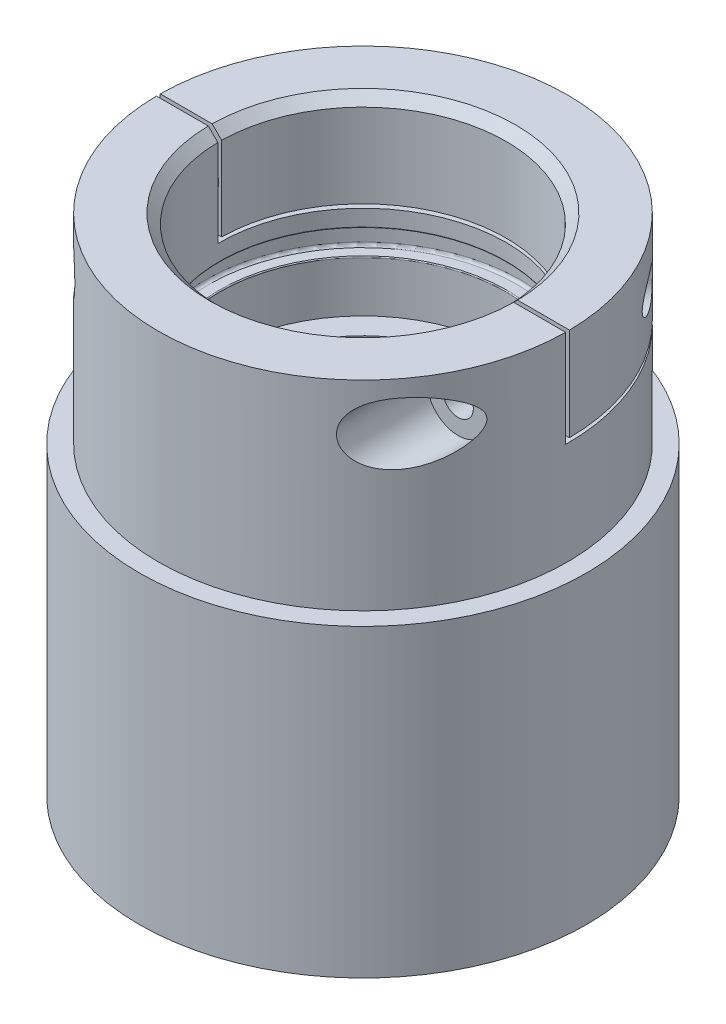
SolidWorks part; units mm, degrees
other "Vue éclatée1" [suppressed]
other "Etape d'éclatement1" [suppressed]
other "Ligne d'éclatement1"
ref_plane "Plan1" through (0, 0, 0) normal (0, 0, 1) x (1, 0, 0)
ref_plane "Plan2" through (0, 0, 0) normal (0, 1, 0) x (1, 0, 0)
ref_plane "Plan3" through (0, 0, 0) normal (1, 0, 0) x (0, 0, -1)
sketch "Esquisse1" plane through (0, 0, 0) normal (0, 0, 1) x (1, 0, 0)
  line L0 (0, 48.8191) -> (0, -8.4315) construction
  line L1 (0, -50) -> (0, 50) construction
  line L2 (15.05, 53) -> (15.05, 41)
  line L3 (12.5, 30) -> (19.3, 30)
  line L4 (19.3, 30) -> (19.3, 2.7475)
  line L5 (20.3, 0) -> (23.5, 0)
  line L6 (23.5, 0) -> (23.5, 32)
  line L7 (21.5, 53) -> (15.05, 53)
  line L8 (50, 0) -> (-50, 0) construction
  line L9 (19.3, 2.7475) -> (20.3, 0)
  line L10 (15.05, 41) -> (16.5, 41)
  line L11 (16.5, 41) -> (16.5, 38.4)
  line L12 (16.5, 38.4) -> (15.05, 38.4)
  line L13 (15.05, 38.4) -> (15.05, 33)
  line L14 (15.05, 33) -> (12.5, 33)
  line L15 (12.5, 33) -> (12.5, 30)
  line L16 (21.5, 32) -> (21.5, 53)
  line L17 (23.5, 32) -> (21.5, 32)
  circle A0 centre (15.825, 39.29) radius 0.89 construction
  dimension "D11" = 1.78
  dimension "D12" = 29.87
  dimension "D1" = 38.6
  dimension "D2" = 30.1
  dimension "D3" = 47
  dimension "D4" = 30
  dimension "D5" = 23
  dimension "D6" = 20
  dimension "D7" = 1
  dimension "D8" = 8
  dimension "D9" = 2.6
  dimension "D10" = 1.45
  dimension "D13" = 25
  dimension "D14" = 3
  dimension "D15" = 43
  dimension "D16" = 2
revolve "Révolution1" add sketch "Esquisse1" angle 360 about L0
hole_wizard "Trou taraudé M21" positions "Esquisse3" profile "Esquisse2" tap size "M2" standard "ISO"
sketch "Esquisse3" plane through (0, 0, 0) normal (0, -1, 0) x (-1, 0, 0)
  circle A0 centre (0, 0) radius 21.5
  point P5 (0, 21.5)
  dimension "D1" = 43
sketch "Esquisse2" plane through (0, 0, -21.5) normal (1, 0, 0) x (0, 0, -1)
  line L0 (0, 0) -> (0, 7.9807)
  line L1 (0, 7.9807) -> (0.8, 7.5)
  line L2 (0.8, 7.5) -> (0.8, 0)
  line L5 (0.8, 0) -> (0, 0)
  line L10 (0, 7.9807) -> (-0.8, 7.5) construction
  line L11 (0, -6.35) -> (0, 107.95) construction
  dimension "Diamètre du trou pour taraudage" = 1.6
  dimension "Profondeur du trou pour taraudage" = 7.5
  dimension "Angle de pointe" = 118
pattern_circular "Répétition circulaire1" count 3 over 360 about axis through (0, 0, 0) along (0, 1, 0) of "Trou taraudé M21"
sketch "Esquisse4" plane through (0, 0, 0) normal (0, 0, 1) x (1, 0, 0)
  line L0 (0, 48.8191) -> (0, -8.4315) construction
  line L1 (0, 48.8191) -> (0, -8.4315) construction
  circle A0 centre (15.825, 39.29) radius 0.89 construction
  circle A1 centre (15.825, 39.29) radius 0.89
revolve "Révolution2" add sketch "Esquisse4" angle 360 about L1
ref_plane "Plan4" through (0, 48, 0) normal (0, 1, 0) x (1, 0, 0)
sketch "Esquisse5" plane through (0, 48, 0) normal (0, 1, 0) x (1, 0, 0)
  line L0 (-17, 22.4362) -> (-17, -38.912) construction
  line L1 (0, -50) -> (0, 50) construction
  line L2 (-17, -27) -> (-17, 0)
  line L3 (-17, 0) -> (-15.4, 0)
  line L4 (-15.4, 0) -> (-15.4, -7)
  line L5 (-15.4, -7) -> (-13.75, -7)
  line L6 (-13.75, -7) -> (-13.75, -27)
  line L7 (-13.75, -27) -> (-17, -27)
  line L8 (-50, 0) -> (50, 0) construction
  dimension "D1" = 17
  dimension "D2" = 3.2
  dimension "D3" = 6.5
  dimension "D4" = 7
  dimension "D5" = 20
revolve "Enlèvement de matière-Révolution1" cut sketch "Esquisse5" angle 360 about L0
hole_wizard "Trou taraudé M41" positions "Esquisse7" profile "Esquisse6" tap size "M4" standard "ISO"
sketch "Esquisse7" plane through (0, 0, 0) normal (0, 0, 1) x (1, 0, 0)
  point P0 (-17, 48)
sketch "Esquisse6" plane through (-17, 48, 0) normal (1, 0, 0) x (0, -1, 0)
  line L0 (0, 0) -> (0, 23.5)
  line L1 (0, 23.5) -> (1.65, 23.5)
  line L2 (1.65, 23.5) -> (1.65, 0)
  line L5 (1.65, 0) -> (0, 0)
  line L11 (0, -6.35) -> (0, 107.95) construction
  dimension "Diamètre du trou pour taraudage jusqu'au prochain" = 3.3
  dimension "Profondeur du trou pour taraudage jusqu'au prochain" = 23.5
mirror "Symétrie1" about plane through (0, 0, 0) normal (1, 0, 0) of "Trou taraudé M41", "Enlèvement de matière-Révolution1"
sketch "Esquisse8" plane through (0, 0, 0) normal (1, 0, 0) x (0, 0, -1)
  line L0 (0, 53) -> (0, 43)
  line L1 (0, 43) -> (40, 43)
  line L2 (0, 50) -> (0, -50) construction
  line L3 (23.5, 53) -> (-23.5, 53) construction
  dimension "D1" = 10
  dimension "D2" = 40
extrude "Enlèv. de mat.-Extru.-Mince1" cut sketch "Esquisse8" against normal through all and the other way through all thin
delete or keep bodies "Corps-Effacer/suppr1" type delete bodies bodies 104
fillet "Congé1" radius 0.3 2 edges at (0, 41, 16.5) (0, 38.4, 16.5)
fillet "Congé2" radius 0.1 2 edges at (0, 38.4, 15.05) (0, 41, 15.05)
chamfer "Chanfrein1" distance 1 angle 45 1 edges at (0, 53, 15.05)
chamfer "Chanfrein2" distance 1 angle 45 1 edges at (0, 53, -15.05)
move or copy body "Corps-Déplacer/Copier1" [suppressed] bodies to move or copy 109 copy no translate (0, 0, -15.0389)
